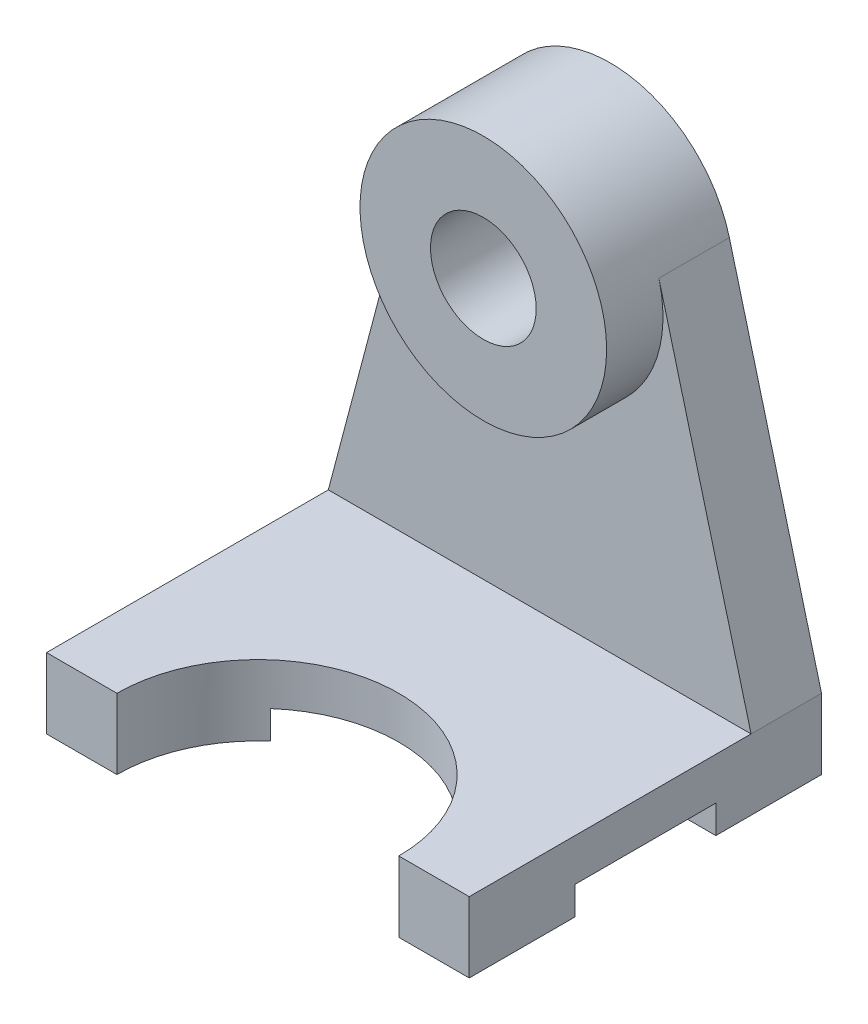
SolidWorks part; units mm, degrees
ref_plane "前视基准面" through (0, 0, 0) normal (0, 0, 1) x (1, 0, 0)
ref_plane "上视基准面" through (0, 0, 0) normal (0, 1, 0) x (1, 0, 0)
ref_plane "右视基准面" through (0, 0, 0) normal (1, 0, 0) x (0, 0, -1)
sketch "草图1" plane through (0, 0, 0) normal (0, 1, 0) x (1, 0, 0)
  line L0 (50, 0) -> (60, 0)
  line L1 (0, 0) -> (10, 0)
  line L2 (0, 0) -> (0, 50)
  line L3 (0, 50) -> (60, 50)
  line L4 (60, 0) -> (60, 50)
  arc A0 (50, 0) -> (10, 0) centre (30, 0) ccw
  dimension "D3" = 40
  dimension "D1" = 50
  dimension "D2" = 60
extrude "拉伸1" add sketch "草图1" along normal blind 10
sketch "草图2" plane through (60, 0, 0) normal (1, 0, 0) x (0, 0, -1)
  line L0 (0, 0) -> (50, 0) construction
  line L1 (15, 0) -> (35, 0)
  line L2 (15, 0) -> (15, 4)
  line L3 (15, 4) -> (35, 4)
  line L4 (35, 0) -> (35, 4)
  line L5 (25, 10) -> (25, 15.2171) construction
  line L6 (0, 10) -> (50, 10) construction
  dimension "D1" = 20
  dimension "D2" = 4
extrude "切除-拉伸1" cut sketch "草图2" against normal through all
sketch "草图4" plane through (0, 0, -50) normal (0, 0, -1) x (-1, 0, 0)
  line L0 (-46.9186, 59.4735) -> (-60, 10)
  line L1 (-13.0814, 59.4735) -> (0, 10)
  line L2 (-60, 10) -> (0, 10) construction
  line L3 (-30, 10) -> (-30, 20.628) construction
  line L4 (-60, 10) -> (0, 10)
  arc A0 (-13.0814, 59.4735) -> (-46.9186, 59.4735) centre (-30, 55) ccw
  circle A1 centre (-30, 55) radius 7.5
  dimension "D2" = 35
  dimension "D3" = 15
  dimension "D1" = 45
extrude "拉伸2" add sketch "草图4" against normal blind 10
sketch "草图5" plane through (0, 0, -40) normal (0, 0, 1) x (1, 0, 0)
  circle A0 centre (30, 55) radius 17.5
  circle A1 centre (30, 55) radius 7.5
extrude "拉伸3" add sketch "草图5" along normal blind 8
